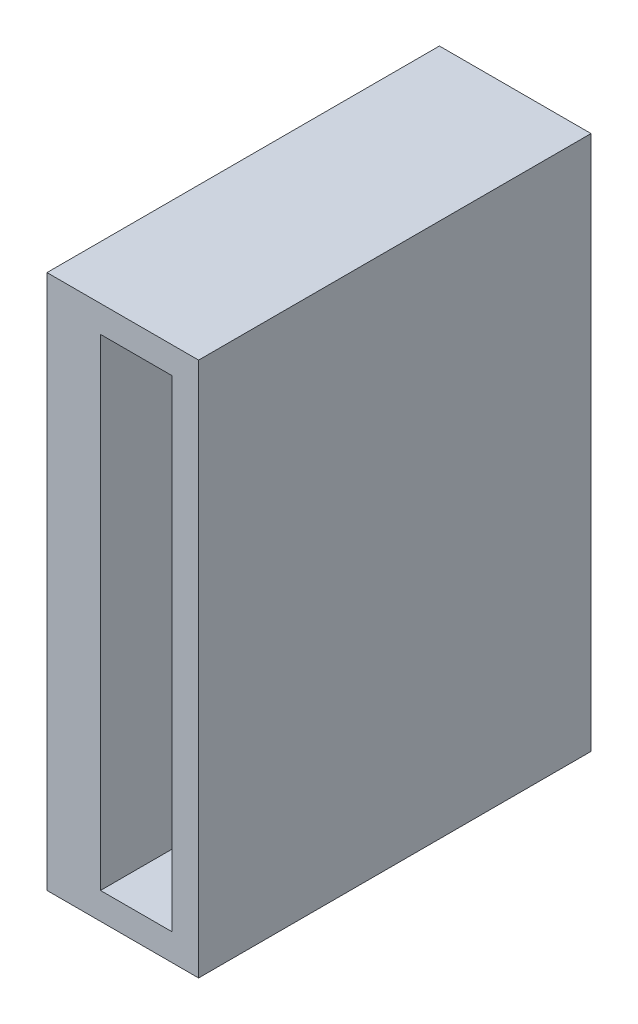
SolidWorks part; units mm, degrees
ref_plane "Alzado" through (0, 0, 0) normal (0, 0, 1) x (1, 0, 0)
ref_plane "Planta" through (0, 0, 0) normal (0, 1, 0) x (1, 0, 0)
ref_plane "Vista lateral" through (0, 0, 0) normal (1, 0, 0) x (0, 0, -1)
sketch "Croquis1" plane through (0, 0, 0) normal (0, 0, 1) x (1, 0, 0)
  line L1 (-4.6665, 5.8295) -> (-1.6665, 5.8295)
  line L2 (-4.6665, 5.8295) -> (-4.6665, -20.1705)
  line L3 (-4.6665, -20.1705) -> (-1.6665, -20.1705)
  line L4 (-1.6665, 5.8295) -> (-1.6665, -20.1705)
  dimension "D1" = 26
  dimension "D2" = 3
extrude "Saliente-Extruir1" add sketch "Croquis1" along normal blind 30
sketch "Croquis5" plane through (0, 0, 0) normal (0, 0, -1) x (-1, 0, 0)
  line L0 (4.6665, 5.8295) -> (4.6665, -20.1705) construction
  line L1 (1.1665, 6.3295) -> (5.1665, 6.3295)
  line L2 (1.1665, 6.3295) -> (1.1665, -20.6705)
  line L3 (1.1665, -20.6705) -> (5.1665, -20.6705)
  line L4 (5.1665, 6.3295) -> (5.1665, -20.6705)
  line L5 (1.6665, -20.1705) -> (1.6665, 5.8295) construction
  line L6 (1.6665, 5.8295) -> (4.6665, 5.8295) construction
  line L7 (4.6665, -20.1705) -> (1.6665, -20.1705) construction
  line L9 (-0.3335, 7.8295) -> (8.1665, 7.8295)
  line L10 (-0.3335, 7.8295) -> (-0.3335, -22.1705)
  line L11 (-0.3335, -22.1705) -> (8.1665, -22.1705)
  line L12 (8.1665, 7.8295) -> (8.1665, -22.1705)
  dimension "D1" = 0.5
  dimension "D2" = 0.5
  dimension "D3" = 0.5
  dimension "D4" = 0.5
  dimension "D5" = 3
  dimension "D6" = 1.5
  dimension "D7" = 1.5
  dimension "D8" = 1.5
extrude "Saliente-Extruir3" add sketch "Croquis5" against normal blind 22 separate body
sketch "Croquis6" plane through (0, 0, 0) normal (0, 0, -1) x (-1, 0, 0)
  line L1 (1.1665, 6.3295) -> (5.1665, 6.3295)
  line L2 (1.1665, 6.3295) -> (1.1665, -20.6705)
  line L3 (1.1665, -20.6705) -> (5.1665, -20.6705)
  line L4 (5.1665, 6.3295) -> (5.1665, -20.6705)
extrude "Cortar-Extruir2" cut sketch "Croquis6" against normal through all
sketch "Croquis7" plane through (0, 0, 0) normal (0, 0, -1) x (-1, 0, 0)
  line L0 (8.1665, 7.8295) -> (-0.3335, 7.8295) construction
  line L1 (5.6665, 2.8295) -> (7.6665, 2.8295)
  line L2 (5.6665, 2.8295) -> (5.6665, -17.1705)
  line L3 (5.6665, -17.1705) -> (7.6665, -17.1705)
  line L4 (7.6665, 2.8295) -> (7.6665, -17.1705)
  line L6 (8.1665, -22.1705) -> (8.1665, 7.8295) construction
  dimension "D1" = 20
  dimension "D2" = 2
  dimension "D3" = 5
  dimension "D4" = 0.5
extrude "Cortar-Extruir3" cut sketch "Croquis7" against normal blind 21
